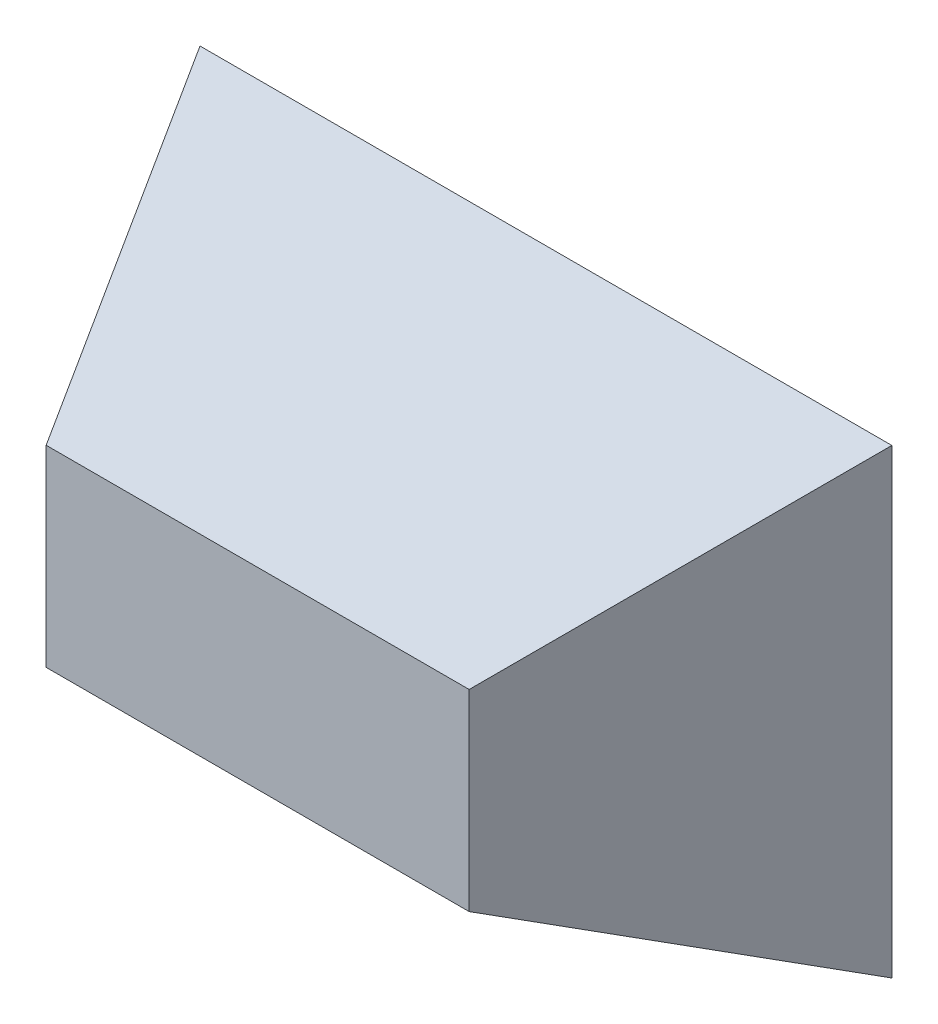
SolidWorks part; units mm, degrees
ref_plane "前视基准面" through (0, 0, 0) normal (0, 0, 1) x (1, 0, 0)
ref_plane "上视基准面" through (0, 0, 0) normal (0, 1, 0) x (1, 0, 0)
ref_plane "右视基准面" through (0, 0, 0) normal (1, 0, 0) x (0, 0, -1)
sketch "草图1" plane through (0, 0, 0) normal (0, 0, 1) x (1, 0, 0)
  line L0 (-100.3592, 0) -> (98.7534, 0) construction
  line L1 (0, -59.8141) -> (0, 60.2155) construction
  line L3 (-60, 40) -> (60, 40)
  line L4 (-60, 40) -> (-60, -40)
  line L5 (-60, -40) -> (60, -40)
  line L6 (60, 40) -> (60, -40)
  dimension "D1" = 120
  dimension "D2" = 80
extrude "拉伸1" add sketch "草图1" along normal blind 50 draft 25
